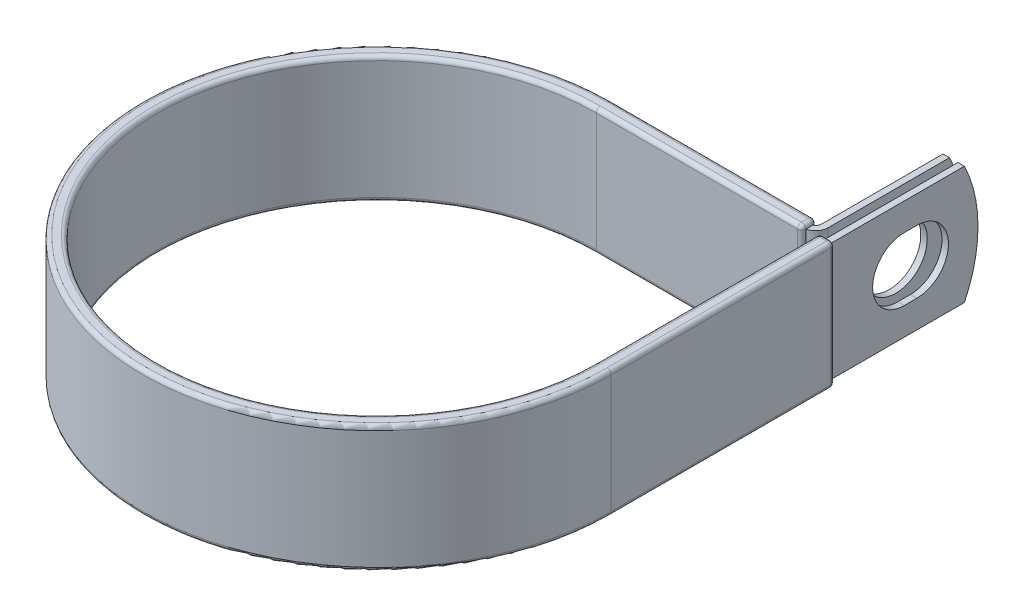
SolidWorks part; units mm, degrees
ref_plane "Front Plane" through (0, 0, 0) normal (0, 0, 1) x (1, 0, 0)
ref_plane "Top Plane" through (0, 0, 0) normal (0, 1, 0) x (1, 0, 0)
ref_plane "Right Plane" through (0, 0, 0) normal (1, 0, 0) x (0, 0, -1)
sketch "Sketch1" plane through (0, 0, 0) normal (0, 1, 0) x (1, 0, 0)
  line L0 (0, 42.0688) -> (38.1165, 42.0688)
  line L1 (42.0688, 0) -> (42.0688, 42.0688)
  line L2 (40.4939, 69.85) -> (40.4939, 44.4462)
  line L5 (42.0688, 42.0688) -> (42.0688, 69.85)
  arc A0 (0, 42.0688) -> (42.0688, 0) centre (0, 0) ccw
  arc A3 (38.1165, 42.0688) -> (40.4939, 44.4462) centre (38.1165, 44.4462) ccw
extrude "Extrude-Thin1" add sketch "Sketch1" along normal mid plane 22.225 thin
sketch "Sketch2" plane through (39.2747, 0, 0) normal (-1, 0, 0) x (0, 0, 1)
  line L0 (-69.85, 11.1125) -> (-69.85, -11.1125) construction
  line L7 (0, 11.1125) -> (0, -11.1125) construction
  circle A0 centre (-57.15, 0) radius 5.9436
  point P2 (-69.85, 0)
extrude "Cut-Extrude1" cut sketch "Sketch2" against normal up to surface (1.2192 mm away)
sketch "Sketch3" plane through (43.288, 0, 0) normal (1, 0, 0) x (0, 0, -1)
  line L0 (55.9562, 0) -> (58.3438, 0) construction
  line L1 (55.9562, 5.9436) -> (58.3438, 5.9436)
  line L2 (55.9562, -5.9436) -> (58.3438, -5.9436)
  line L3 (69.85, 11.1125) -> (69.85, -11.1125) construction
  arc A0 (55.9562, 5.9436) -> (55.9562, -5.9436) centre (55.9562, 0) ccw
  arc A1 (58.3438, -5.9436) -> (58.3438, 5.9436) centre (58.3438, 0) ccw
  point P3 (57.15, 0)
  point P8 (69.85, 0)
  point P11 (50.0126, 0)
  point P12 (64.2874, 0)
extrude "Cut-Extrude2" cut sketch "Sketch3" against normal up to surface (1.2192 mm away)
sketch "Sketch4" plane through (39.2747, 0, 0) normal (-1, 0, 0) x (0, 0, 1)
  line L0 (-69.85, 11.1125) -> (-69.85, -11.1125)
  line L1 (-69.85, 11.1125) -> (-67.2901, 11.1125)
  line L2 (-69.85, 11.1125) -> (-44.4462, 11.1125) construction
  line L3 (-69.85, -11.1125) -> (-67.2901, -11.1125)
  line L4 (-69.85, -11.1125) -> (-44.4462, -11.1125) construction
  arc A0 (-67.2901, 11.1125) -> (-67.2901, -11.1125) centre (-44.45, 0) ccw
extrude "Cut-Extrude3" cut sketch "Sketch4" against normal through all contours A0 M4 M5 | A0 L0 M2
ref_plane "Plane1" through (0, 0, -42.0688) normal (0, 0, 1) x (1, 0, 0)
ref_plane "Plane2" through (0, 0, 0) normal (-1, 0, 0) x (0, 0, 1)
sketch "Sketch5" plane through (0, 0, -42.0688) normal (0, 0, 1) x (1, 0, 0)
  line L0 (42.0688, 11.1125) -> (43.288, 11.1125)
  line L1 (42.0688, -11.1125) -> (42.0688, 11.1125)
  line L2 (41.275, -11.1442) -> (41.275, 11.1442)
  line L3 (43.288, 11.1125) -> (43.288, -11.1125)
  line L4 (43.288, -11.1125) -> (42.0688, -11.1125)
  line L5 (42.037, 11.9062) -> (43.3197, 11.9062)
  line L7 (44.0817, 11.1442) -> (44.0817, -11.1443)
  line L8 (43.3197, -11.9062) -> (42.037, -11.9062)
  line L9 (41.275, -11.9062) -> (41.275, 11.9062) construction
  line L11 (44.0817, -11.9062) -> (41.275, -11.9062) construction
  line L12 (44.0817, 11.9062) -> (44.0817, -11.9062) construction
  line L13 (41.275, 11.9062) -> (44.0817, 11.9062) construction
  arc A0 (41.275, -11.1442) -> (42.037, -11.9062) centre (42.037, -11.1442) ccw
  arc A1 (44.0817, -11.1443) -> (43.3197, -11.9062) centre (43.3197, -11.1442) cw
  arc A2 (41.275, 11.1442) -> (42.037, 11.9062) centre (42.037, 11.1442) cw
  arc A3 (43.3197, 11.9062) -> (44.0817, 11.1442) centre (43.3197, 11.1442) cw
sketch "Sketch6" plane through (0, 11.1125, 0) normal (0, 1, 0) x (1, 0, 0)
  line L0 (41.275, 0) -> (41.275, 42.0688)
  line L1 (0, 41.275) -> (38.6398, 41.275)
  line L2 (39.2748, 67.2901) -> (39.2748, 44.4462) construction
  arc A0 (0, 41.275) -> (41.275, 0) centre (0, 0) ccw
sweep "Sweep1" add profiles "Sketch5" path "Sketch6"
fillet "Fillet1" radius 0.762 16 edges at (38.6398, 11.6831, -43.8585) (38.6398, 0, -44.0817) (38.6398, -11.6831, -43.8585) (38.6398, -11.9062, -42.6784) (38.6398, -11.6831, -41.4982) (38.6398, 0, -41.275) (38.6398, 11.6831, -41.4982) (43.8585, 11.6831, -42.0688) (44.0817, 0, -42.0688) (43.8585, -11.6831, -42.0688) (42.6784, -11.9062, -42.0688) (41.4982, -11.6831, -42.0688) (41.275, 0, -42.0688) (41.4982, 11.6831, -42.0688) (38.6398, 11.9062, -42.6784) (42.6784, 11.9062, -42.0688)
equation "\"D4@Sketch5\" = \"D1@Extrude-Thin1\""
equation "\"D5@Sketch5\" = \"D5@Extrude-Thin1\""
equation "\"D1@Sketch3\" = \"D2@Sketch2\""
equation "\"D7@Sketch1\" = \"D3@Sketch2\" + \"D1@Sketch3\""
equation "\"D1@Sketch1\" = \"D1@Sketch6\" + 2 * \"D3@Sketch5\""
equation "\"D1@Sketch4\" = ( \"D1@Extrude-Thin1\" + .125 ) * 2"
equation "\"D2@Sketch1\"=1.95*\"D5@Extrude-Thin1\""
equation "\"D2@Sketch3\" = \"D1@Sketch2\""
